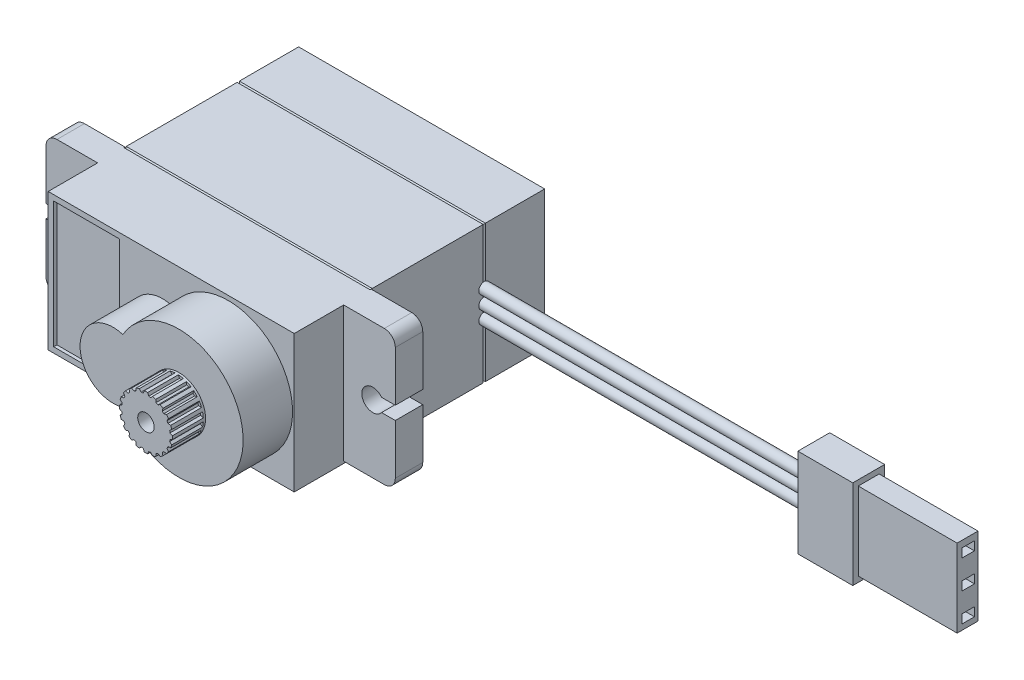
SolidWorks part; units mm, degrees
ref_plane "前视基准面" through (0, 0, 0) normal (0, 0, 1) x (1, 0, 0)
ref_plane "上视基准面" through (0, 0, 0) normal (0, 1, 0) x (1, 0, 0)
ref_plane "右视基准面" through (0, 0, 0) normal (1, 0, 0) x (0, 0, -1)
sketch "草图1" plane through (0, 0, 0) normal (0, 0, 1) x (1, 0, 0)
  line L1 (-11.2, 6.25) -> (11.2, 6.25)
  line L2 (-11.2, 6.25) -> (-11.2, -6.25)
  line L3 (-11.2, -6.25) -> (11.2, -6.25)
  line L4 (11.2, 6.25) -> (11.2, -6.25)
  dimension "D1" = 11.2
  dimension "D2" = 22.4
  dimension "D3" = 6.25
  dimension "D4" = 12.5
extrude "凸台-拉伸1" add sketch "草图1" along normal blind 5.5
chamfer "倒角1" distance 0.1 angle 45 4 edges at (0, 6.25, 5.5) (11.2, 0, 5.5) (0, -6.25, 5.5) (-11.2, 0, 5.5)
sketch "草图2" plane through (0, 0, 5.5) normal (0, 0, 1) x (1, 0, 0)
  line L0 (11.2, 6.25) -> (11.2, -6.25) construction
  line L1 (11.2, -6.25) -> (-11.2, -6.25) construction
  line L2 (-11.2, -6.25) -> (-11.2, 6.25) construction
  line L3 (-11.2, 6.25) -> (11.2, 6.25) construction
  line L12 (11.2, 6.25) -> (11.2, -6.25)
  line L13 (11.2, -6.25) -> (-11.2, -6.25)
  line L14 (-11.2, -6.25) -> (-11.2, 6.25)
  line L15 (-11.2, 6.25) -> (11.2, 6.25)
extrude "凸台-拉伸2" add sketch "草图2" along normal blind 10.3
chamfer "倒角2" distance 0.1 angle 45 4 edges at (0, 6.25, 5.5) (11.2, 0, 5.5) (0, -6.25, 5.5) (-11.2, 0, 5.5)
chamfer "倒角3" distance 0.1 angle 45 4 edges at (11.2, 0, 15.8) (0, -6.25, 15.8) (-11.2, 0, 15.8) (0, 6.25, 15.8)
sketch "草图3" plane through (0, 0, 15.8) normal (0, 0, 1) x (1, 0, 0)
  line L0 (11.2, 6.25) -> (11.2, -6.25) construction
  line L1 (11.2, -6.25) -> (-11.2, -6.25) construction
  line L2 (-11.2, -6.25) -> (-11.2, 6.25) construction
  line L3 (-11.2, 6.25) -> (11.2, 6.25) construction
  line L4 (11.2, 6.25) -> (11.2, -6.25)
  line L5 (11.2, -6.25) -> (-11.2, -6.25)
  line L6 (-11.2, -6.25) -> (-11.2, 6.25)
  line L7 (-11.2, 6.25) -> (11.2, 6.25)
extrude "凸台-拉伸3" add sketch "草图3" along normal blind 7
chamfer "倒角4" distance 0.1 angle 45 4 edges at (0, 6.25, 15.8) (11.2, 0, 15.8) (0, -6.25, 15.8) (-11.2, 0, 15.8)
ref_plane "基准面1" through (0, 0, 15.8) normal (0, 0, 1) x (1, 0, 0)
sketch "草图4" plane through (0, 0, 15.8) normal (0, 0, 1) x (1, 0, 0)
  line L0 (-15.9, -0.5083) -> (-15.9, -6.0667)
  line L1 (-11.2, 6.25) -> (-15.9, 6.25)
  line L2 (-11.2, 6.25) -> (-11.2, -6.0667)
  line L3 (-11.2, -6.0667) -> (-15.9, -6.0667)
  line L4 (-15.9, 6.25) -> (-15.9, 0.6917)
  line L6 (11.2, -6.0667) -> (15.9, -6.0667)
  line L7 (15.9, -0.5083) -> (14.65, -0.5083)
  line L8 (15.9, 0.6917) -> (14.65, 0.6917)
  line L9 (-15.9, -0.5083) -> (-14.65, -0.5083)
  line L10 (-15.9, 0.6917) -> (-14.65, 0.6917)
  line L11 (15.9, 6.25) -> (15.9, 0.6917)
  line L12 (11.2, 6.25) -> (11.2, -6.0667)
  line L13 (11.2, 6.25) -> (15.9, 6.25)
  line L14 (15.9, -0.5083) -> (15.9, -6.0667)
  arc A0 (-14.65, -0.5083) -> (-14.65, 0.6917) centre (-13.85, 0.0917) ccw
  arc A1 (14.65, -0.5083) -> (14.65, 0.6917) centre (13.85, 0.0917) cw
  point P19 (12.306, -0.5083)
  point P21 (12.306, 0.6917)
  dimension "D4" = 2
extrude "凸台-拉伸4" add sketch "草图4" along normal blind 2.5
sketch "草图5" plane through (0, 0, 22.8) normal (0, 0, 1) x (1, 0, 0)
  arc A0 (0.0981, -2.8624) -> (0.0981, 2.8624) centre (5.2, 0) ccw
  arc A1 (0.0981, 2.8624) -> (0.0981, -2.8624) centre (-0.8, 0) ccw
  dimension "D2" = 11.7
  dimension "D5" = 6
extrude "凸台-拉伸5" add sketch "草图5" along normal blind 4.5
sketch "草图6" plane through (0, 0, 27.3) normal (0, 0, 1) x (1, 0, 0)
  circle A0 centre (5.2, 0) radius 2.425
  dimension "D1" = 4.85
extrude "凸台-拉伸6" add sketch "草图6" along normal blind 3
sketch "草图7" plane through (0, 0, 30.3) normal (0, 0, 1) x (1, 0, 0)
  circle A0 centre (5.2, 0) radius 0.75
  dimension "D1" = 1.5
extrude "切除-拉伸1" cut sketch "草图7" against normal blind 6
sketch "草图8" plane through (0, 0, 30.3) normal (0, 0, 1) x (1, 0, 0)
  line L1 (4.95, 2.1857) -> (5.05, 2.4204)
  line L2 (5.45, 2.1857) -> (5.35, 2.4204)
  line L3 (6.1132, 2.0015) -> (6.0906, 2.2555)
  line L4 (5.6377, 2.156) -> (5.8053, 2.3482)
  line L5 (6.687, 1.6214) -> (6.744, 1.8699)
  line L6 (6.2825, 1.9153) -> (6.5013, 2.0463)
  line L7 (7.1153, 1.0825) -> (7.2463, 1.3013)
  line L8 (6.8214, 1.487) -> (7.0699, 1.544)
  line L9 (7.356, 0.4377) -> (7.5482, 0.6053)
  line L10 (7.2015, 0.9132) -> (7.4555, 0.8906)
  line L11 (7.3857, -0.25) -> (7.6204, -0.15)
  line L12 (7.3857, 0.25) -> (7.6204, 0.15)
  line L13 (7.2015, -0.9132) -> (7.4555, -0.8906)
  line L14 (7.356, -0.4377) -> (7.5482, -0.6053)
  line L15 (6.8214, -1.487) -> (7.0699, -1.544)
  line L16 (7.1153, -1.0825) -> (7.2463, -1.3013)
  line L17 (6.2825, -1.9153) -> (6.5013, -2.0463)
  line L18 (6.687, -1.6214) -> (6.744, -1.8699)
  line L19 (5.6377, -2.156) -> (5.8053, -2.3482)
  line L20 (6.1132, -2.0015) -> (6.0906, -2.2555)
  line L21 (4.95, -2.1857) -> (5.05, -2.4204)
  line L22 (5.45, -2.1857) -> (5.35, -2.4204)
  line L23 (4.2868, -2.0015) -> (4.3094, -2.2555)
  line L24 (4.7623, -2.156) -> (4.5947, -2.3482)
  line L25 (3.713, -1.6214) -> (3.656, -1.8699)
  line L26 (4.1175, -1.9153) -> (3.8987, -2.0463)
  line L27 (3.2847, -1.0825) -> (3.1537, -1.3013)
  line L28 (3.5786, -1.487) -> (3.3301, -1.544)
  line L29 (3.044, -0.4377) -> (2.8518, -0.6053)
  line L30 (3.1985, -0.9132) -> (2.9445, -0.8906)
  line L31 (3.0143, 0.25) -> (2.7796, 0.15)
  line L32 (3.0143, -0.25) -> (2.7796, -0.15)
  line L33 (3.1985, 0.9132) -> (2.9445, 0.8906)
  line L34 (3.044, 0.4377) -> (2.8518, 0.6053)
  line L35 (3.5786, 1.487) -> (3.3301, 1.544)
  line L36 (3.2847, 1.0825) -> (3.1537, 1.3013)
  line L37 (4.1175, 1.9153) -> (3.8987, 2.0463)
  line L38 (3.713, 1.6214) -> (3.656, 1.8699)
  line L39 (4.7623, 2.156) -> (4.5947, 2.3482)
  line L40 (4.2868, 2.0015) -> (4.3094, 2.2555)
  arc A0 (4.95, 2.1857) -> (4.7623, 2.156) centre (5.2, 0) ccw
  circle A1 centre (5.2, 0) radius 2.425 construction
  arc A2 (5.05, 2.4204) -> (4.5947, 2.3482) centre (5.2, 0) ccw
  arc A3 (4.2868, 2.0015) -> (4.1175, 1.9153) centre (5.2, 0) ccw
  arc A4 (4.3094, 2.2555) -> (3.8987, 2.0463) centre (5.2, 0) ccw
  arc A5 (5.6377, 2.156) -> (5.45, 2.1857) centre (5.2, 0) ccw
  arc A6 (5.8053, 2.3482) -> (5.35, 2.4204) centre (5.2, 0) ccw
  arc A7 (6.2825, 1.9153) -> (6.1132, 2.0015) centre (5.2, 0) ccw
  arc A8 (6.5013, 2.0463) -> (6.0906, 2.2555) centre (5.2, 0) ccw
  arc A9 (7.0699, 1.544) -> (6.744, 1.8699) centre (5.2, 0) ccw
  arc A10 (6.8214, 1.487) -> (6.687, 1.6214) centre (5.2, 0) ccw
  arc A11 (7.4555, 0.8906) -> (7.2463, 1.3013) centre (5.2, 0) ccw
  arc A12 (7.2015, 0.9132) -> (7.1153, 1.0825) centre (5.2, 0) ccw
  arc A13 (7.6204, 0.15) -> (7.5482, 0.6053) centre (5.2, 0) ccw
  arc A14 (7.3857, 0.25) -> (7.356, 0.4377) centre (5.2, 0) ccw
  arc A15 (7.5482, -0.6053) -> (7.6204, -0.15) centre (5.2, 0) ccw
  arc A16 (7.356, -0.4377) -> (7.3857, -0.25) centre (5.2, 0) ccw
  arc A17 (7.2463, -1.3013) -> (7.4555, -0.8906) centre (5.2, 0) ccw
  arc A18 (7.1153, -1.0825) -> (7.2015, -0.9132) centre (5.2, 0) ccw
  arc A19 (6.744, -1.8699) -> (7.0699, -1.544) centre (5.2, 0) ccw
  arc A20 (6.687, -1.6214) -> (6.8214, -1.487) centre (5.2, 0) ccw
  arc A21 (6.0906, -2.2555) -> (6.5013, -2.0463) centre (5.2, 0) ccw
  arc A22 (6.1132, -2.0015) -> (6.2825, -1.9153) centre (5.2, 0) ccw
  arc A23 (5.35, -2.4204) -> (5.8053, -2.3482) centre (5.2, 0) ccw
  arc A24 (5.45, -2.1857) -> (5.6377, -2.156) centre (5.2, 0) ccw
  arc A25 (4.5947, -2.3482) -> (5.05, -2.4204) centre (5.2, 0) ccw
  arc A26 (4.7623, -2.156) -> (4.95, -2.1857) centre (5.2, 0) ccw
  arc A27 (3.8987, -2.0463) -> (4.3094, -2.2555) centre (5.2, 0) ccw
  arc A28 (4.1175, -1.9153) -> (4.2868, -2.0015) centre (5.2, 0) ccw
  arc A29 (3.5786, -1.487) -> (3.713, -1.6214) centre (5.2, 0) ccw
  arc A30 (3.3301, -1.544) -> (3.656, -1.8699) centre (5.2, 0) ccw
  arc A31 (3.1985, -0.9132) -> (3.2847, -1.0825) centre (5.2, 0) ccw
  arc A32 (2.9445, -0.8906) -> (3.1537, -1.3013) centre (5.2, 0) ccw
  arc A33 (3.0143, -0.25) -> (3.044, -0.4377) centre (5.2, 0) ccw
  arc A34 (2.7796, -0.15) -> (2.8518, -0.6053) centre (5.2, 0) ccw
  arc A35 (3.044, 0.4377) -> (3.0143, 0.25) centre (5.2, 0) ccw
  arc A36 (2.8518, 0.6053) -> (2.7796, 0.15) centre (5.2, 0) ccw
  arc A37 (3.2847, 1.0825) -> (3.1985, 0.9132) centre (5.2, 0) ccw
  arc A38 (3.1537, 1.3013) -> (2.9445, 0.8906) centre (5.2, 0) ccw
  arc A39 (3.713, 1.6214) -> (3.5786, 1.487) centre (5.2, 0) ccw
  arc A40 (3.656, 1.8699) -> (3.3301, 1.544) centre (5.2, 0) ccw
  point P90 (5.2, 0)
  dimension "D1" = 4.4
extrude "切除-拉伸2" cut sketch "草图8" against normal blind 2.8
sketch "草图9" plane through (11.2, 0, 0) normal (1, 0, 0) x (0, 0, -1)
  line L0 (-5.5, -6.15) -> (-5.5, 6.15) construction
  circle A0 centre (-5.5, 0) radius 0.5
  circle A1 centre (-5.5, 1.2) radius 0.5
  circle A2 centre (-5.5, -1.2) radius 0.5
  dimension "D1" = 1
  dimension "D2" = 1.2
  dimension "D3" = 1
  dimension "D4" = 1
  dimension "D5" = 1.2
extrude "凸台-拉伸7" add sketch "草图9" along normal blind 30
sketch "草图10" plane through (41.2, 0, 0) normal (1, 0, 0) x (0, 0, -1)
  line L3 (-6.95, 4.05) -> (-4.05, 4.05)
  line L4 (-6.95, 4.05) -> (-6.95, -4.05)
  line L5 (-6.95, -4.05) -> (-4.05, -4.05)
  line L6 (-4.05, 4.05) -> (-4.05, -4.05)
  dimension "D2" = 2.9
  dimension "D4" = 8.1
extrude "凸台-拉伸8" add sketch "草图10" along normal blind 5
sketch "草图11" plane through (46.2, 0, 0) normal (1, 0, 0) x (0, 0, -1)
  line L5 (-6.0289, 2.95) -> (-4.8734, 2.95)
  line L6 (-6.0289, 2.95) -> (-6.0289, 2.15)
  line L7 (-6.0289, 2.15) -> (-4.8734, 2.15)
  line L16 (-6.45, 3.55) -> (-6.45, -3.55)
  line L17 (-6.45, -3.55) -> (-4.55, -3.55)
  line L18 (-4.55, -3.55) -> (-4.55, 3.55)
  line L19 (-4.55, 3.55) -> (-6.45, 3.55)
  line L20 (-6.45, 3.55) -> (-6.45, -3.55)
  line L21 (-6.45, -3.55) -> (-4.55, -3.55)
  line L22 (-4.55, -3.55) -> (-4.55, 3.55)
  line L23 (-4.55, 3.55) -> (-6.45, 3.55)
  line L24 (-4.8734, 2.95) -> (-4.8734, 2.15)
  line L25 (-6.0289, 0.35) -> (-4.8734, 0.35)
  line L26 (-6.0289, 0.35) -> (-6.0289, -0.45)
  line L27 (-6.0289, -0.45) -> (-4.8734, -0.45)
  line L28 (-4.8734, 0.35) -> (-4.8734, -0.45)
  line L29 (-6.0289, -2.25) -> (-4.8734, -2.25)
  line L30 (-6.0289, -2.25) -> (-6.0289, -3.05)
  line L31 (-6.0289, -3.05) -> (-4.8734, -3.05)
  line L32 (-4.8734, -2.25) -> (-4.8734, -3.05)
  dimension "D1" = 0.8
  dimension "D3" = 0.8
  dimension "D4" = 0.8
  dimension "D5" = 0.6
  dimension "D6" = 1.8
  dimension "D7" = 1.8
  dimension "D2" = 0.5
extrude "凸台-拉伸9" add sketch "草图11" along normal blind 9
fillet "圆角2" radius 1 4 edges at (15.9, 6.25, 17.05) (15.9, -6.0667, 17.05) (-15.9, 6.25, 17.05) (-15.9, -6.0667, 17.05)
sketch "草图12" plane through (0, 0, 22.8) normal (0, 0, 1) x (1, 0, 0)
  line L0 (11.2, 6.25) -> (-11.2, 6.25) construction
  line L1 (-10.7, 5.75) -> (-4.7, 5.75)
  line L2 (-10.7, 5.75) -> (-10.7, -5.75)
  line L3 (-10.7, -5.75) -> (-4.7, -5.75)
  line L4 (-4.7, 5.75) -> (-4.7, -5.75)
  line L5 (-11.2, -6.25) -> (11.2, -6.25) construction
  line L6 (-11.2, -6.0667) -> (-11.2, 6.25) construction
  dimension "D1" = 6
  dimension "D2" = 0.5
  dimension "D3" = 0.5
  dimension "D4" = 0.5
extrude "切除-拉伸3" cut sketch "草图12" against normal blind 0.3
sketch "草图13" plane through (0, 0, 0) normal (0, 0, -1) x (-1, 0, 0)
  line L5 (-10.15, 5.7858) -> (-10.15, 5.15)
  line L6 (-9.85, -5.15) -> (-9.2142, -5.15)
  line L7 (-9.85, -4.85) -> (-9.2142, -4.85)
  line L8 (-9.85, 5.7858) -> (-9.85, 5.15)
  line L9 (-9.85, -4.85) -> (-9.85, -4.2142)
  line L10 (-10.15, -4.85) -> (-10.15, -4.2142)
  line L11 (-10.7858, -4.85) -> (-10.15, -4.85)
  line L12 (-10.7858, -5.15) -> (-10.15, -5.15)
  line L13 (-9.85, 4.85) -> (-9.85, 4.2142)
  line L14 (-9.85, 5.15) -> (-9.2142, 5.15)
  line L15 (-10.15, -5.7858) -> (-10.15, -5.15)
  line L16 (-10.15, 4.85) -> (-10.15, 4.2142)
  line L17 (-9.85, -5.7858) -> (-9.85, -5.15)
  line L18 (-9.85, 4.85) -> (-9.2142, 4.85)
  line L19 (9.85, -4.85) -> (9.2142, -4.85)
  line L20 (9.85, -5.15) -> (9.2142, -5.15)
  line L21 (9.85, -5.7858) -> (9.85, -5.15)
  line L22 (10.15, -5.7858) -> (10.15, -5.15)
  line L23 (10.7858, -5.15) -> (10.15, -5.15)
  line L24 (10.7858, -4.85) -> (10.15, -4.85)
  line L25 (-10.7858, 4.85) -> (-10.15, 4.85)
  line L26 (-10.7858, 5.15) -> (-10.15, 5.15)
  line L27 (10.15, -4.85) -> (10.15, -4.2142)
  line L28 (9.85, -4.85) -> (9.85, -4.2142)
  line L29 (10.15, 5.7858) -> (10.15, 5.15)
  line L30 (10.7858, 5.15) -> (10.15, 5.15)
  line L31 (10.7858, 4.85) -> (10.15, 4.85)
  line L32 (10.15, 4.85) -> (10.15, 4.2142)
  line L33 (9.85, 4.85) -> (9.85, 4.2142)
  line L34 (9.85, 4.85) -> (9.2142, 4.85)
  line L35 (9.85, 5.15) -> (9.2142, 5.15)
  line L36 (9.85, 5.7858) -> (9.85, 5.15)
  circle A1 centre (-10, 5) radius 1
  arc A2 (-10.7858, 5.15) -> (-10.7858, 4.85) centre (-10, 5) ccw
  arc A3 (-9.85, 5.7858) -> (-10.15, 5.7858) centre (-10, 5) ccw
  arc A4 (-9.2142, 4.85) -> (-9.2142, 5.15) centre (-10, 5) ccw
  arc A5 (-10.15, 4.2142) -> (-9.85, 4.2142) centre (-10, 5) ccw
  arc A6 (-9.2142, -4.85) -> (-9.2142, -5.15) centre (-10, -5) cw
  arc A7 (-10.15, -4.2142) -> (-9.85, -4.2142) centre (-10, -5) cw
  arc A8 (-10.7858, -5.15) -> (-10.7858, -4.85) centre (-10, -5) cw
  arc A9 (-9.85, -5.7858) -> (-10.15, -5.7858) centre (-10, -5) cw
  circle A10 centre (-10, -5) radius 1
  arc A11 (9.2142, -4.85) -> (9.2142, -5.15) centre (10, -5) ccw
  arc A12 (9.85, -5.7858) -> (10.15, -5.7858) centre (10, -5) ccw
  arc A13 (10.7858, -5.15) -> (10.7858, -4.85) centre (10, -5) ccw
  arc A14 (10.15, -4.2142) -> (9.85, -4.2142) centre (10, -5) ccw
  circle A15 centre (10, -5) radius 1
  arc A16 (10.7858, 5.15) -> (10.7858, 4.85) centre (10, 5) cw
  arc A17 (10.15, 4.2142) -> (9.85, 4.2142) centre (10, 5) cw
  arc A18 (9.2142, 4.85) -> (9.2142, 5.15) centre (10, 5) cw
  arc A19 (9.85, 5.7858) -> (10.15, 5.7858) centre (10, 5) cw
  circle A20 centre (10, 5) radius 1
  point P20 (-10.15, 6.25)
  point P21 (-10.15, -9.7753)
  point P22 (-11.2, 4.85)
  point P23 (14.1671, 4.85)
  point P24 (-9.85, 6.25)
  point P25 (-9.85, -9.7753)
  point P26 (-11.2, 5.15)
  point P27 (14.1671, 5.15)
  dimension "D5" = 2
  dimension "D6" = 1.6
extrude "凸台-拉伸10" add sketch "草图13" along normal blind 0.1
